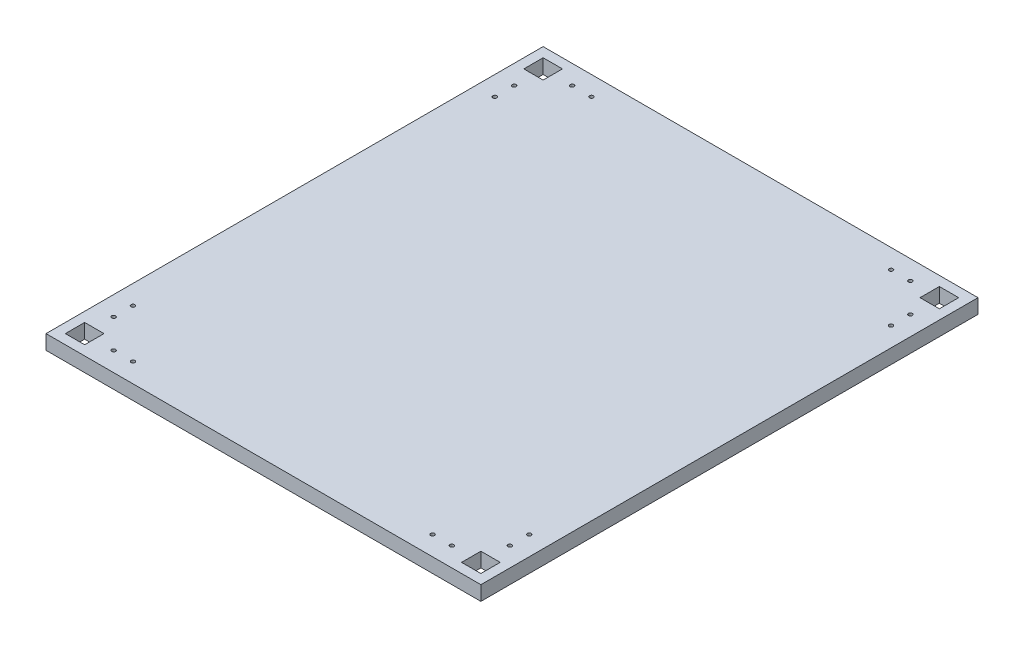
SolidWorks part; units mm, degrees
ref_plane "Front Plane" through (0, 0, 0) normal (0, 0, 1) x (1, 0, 0)
ref_plane "Top Plane" through (0, 0, 0) normal (0, 1, 0) x (1, 0, 0)
ref_plane "Right Plane" through (0, 0, 0) normal (1, 0, 0) x (0, 0, -1)
sketch "Sketch1" plane through (0, 0, 0) normal (0, 1, 0) x (1, 0, 0)
  line L1 (-225, -257.2) -> (225, -257.2)
  line L2 (-225, -257.2) -> (-225, 257.2)
  line L3 (-225, 257.2) -> (225, 257.2)
  line L4 (225, -257.2) -> (225, 257.2)
  line L5 (-225, -257.2) -> (225, 257.2) construction
  line L6 (-225, 257.2) -> (225, -257.2) construction
  point P0 (0, 0)
  dimension "D1" = 514.4
  dimension "430" = 450
extrude "Boss-Extrude1" add sketch "Sketch1" along normal blind 15
sketch "Sketch2" plane through (0, 15, 0) normal (0, 1, 0) x (1, 0, 0)
  line L0 (225, -257.2) -> (225, 257.2) construction
  line L1 (215, 247.2) -> (195, 247.2)
  line L2 (215, 247.2) -> (215, 227.2)
  line L3 (215, 227.2) -> (195, 227.2)
  line L4 (195, 247.2) -> (195, 227.2)
  line L5 (215, 247.2) -> (195, 227.2) construction
  line L6 (215, 227.2) -> (195, 247.2) construction
  line L7 (225, 257.2) -> (-225, 257.2) construction
  line L8 (-384.5208, 0) -> (381.0952, 0) construction
  line L9 (0, 346.9557) -> (0, -317.4672) construction
  line L10 (-215, 227.2) -> (-195, 247.2) construction
  line L11 (-215, 247.2) -> (-195, 227.2) construction
  line L12 (-195, 247.2) -> (-195, 227.2)
  line L13 (-215, 227.2) -> (-195, 227.2)
  line L14 (-215, 247.2) -> (-215, 227.2)
  line L15 (-215, 247.2) -> (-195, 247.2)
  line L16 (-215, -247.2) -> (-195, -227.2) construction
  line L17 (-215, -227.2) -> (-195, -247.2) construction
  line L18 (0, -346.9557) -> (0, 317.4672) construction
  line L19 (215, -227.2) -> (195, -247.2) construction
  line L20 (215, -247.2) -> (195, -227.2) construction
  line L21 (-215, -247.2) -> (-195, -247.2)
  line L22 (-215, -247.2) -> (-215, -227.2)
  line L23 (-215, -227.2) -> (-195, -227.2)
  line L24 (-195, -247.2) -> (-195, -227.2)
  line L25 (195, -247.2) -> (195, -227.2)
  line L26 (215, -227.2) -> (195, -227.2)
  line L27 (215, -247.2) -> (215, -227.2)
  line L28 (215, -247.2) -> (195, -247.2)
  point P0 (205, 237.2)
  point P5 (215, 237.2)
  point P19 (-205, 237.2)
  point P30 (-205, -237.2)
  point P31 (205, -237.2)
  dimension "D1" = 20
  dimension "D2" = 20
  dimension "D3" = 10
  dimension "D4" = 10
extrude "Cut-Extrude1" cut sketch "Sketch2" against normal blind 15
sketch "Sketch3" plane through (0, 15, 0) normal (0, 1, 0) x (1, 0, 0)
  line L0 (-225, 257.2) -> (-225, -257.2) construction
  line L1 (225, 257.2) -> (-225, 257.2) construction
  line L2 (0, 346.0929) -> (0, -313.7539) construction
  line L3 (-420.0997, 0) -> (361.58, 0) construction
  circle A0 centre (-175, 237.2) radius 2
  circle A1 centre (-155, 237.2) radius 2
  circle A2 centre (-205, 207.2) radius 2
  circle A3 centre (-205, 187.2) radius 2
  circle A4 centre (205, 187.2) radius 2
  circle A5 centre (205, 207.2) radius 2
  circle A6 centre (155, 237.2) radius 2
  circle A7 centre (175, 237.2) radius 2
  circle A8 centre (175, -237.2) radius 2
  circle A9 centre (155, -237.2) radius 2
  circle A10 centre (205, -207.2) radius 2
  circle A11 centre (205, -187.2) radius 2
  circle A12 centre (-205, -187.2) radius 2
  circle A13 centre (-205, -207.2) radius 2
  circle A14 centre (-155, -237.2) radius 2
  circle A15 centre (-175, -237.2) radius 2
  dimension "D1" = 4
  dimension "D2" = 4
  dimension "D3" = 4
  dimension "D4" = 4
  dimension "D5" = 70
  dimension "D6" = 20
  dimension "D7" = 20
  dimension "D8" = 20
  dimension "D9" = 70
  dimension "D10" = 20
  dimension "D11" = 20
  dimension "D12" = 20
extrude "Cut-Extrude2" cut sketch "Sketch3" against normal through all
